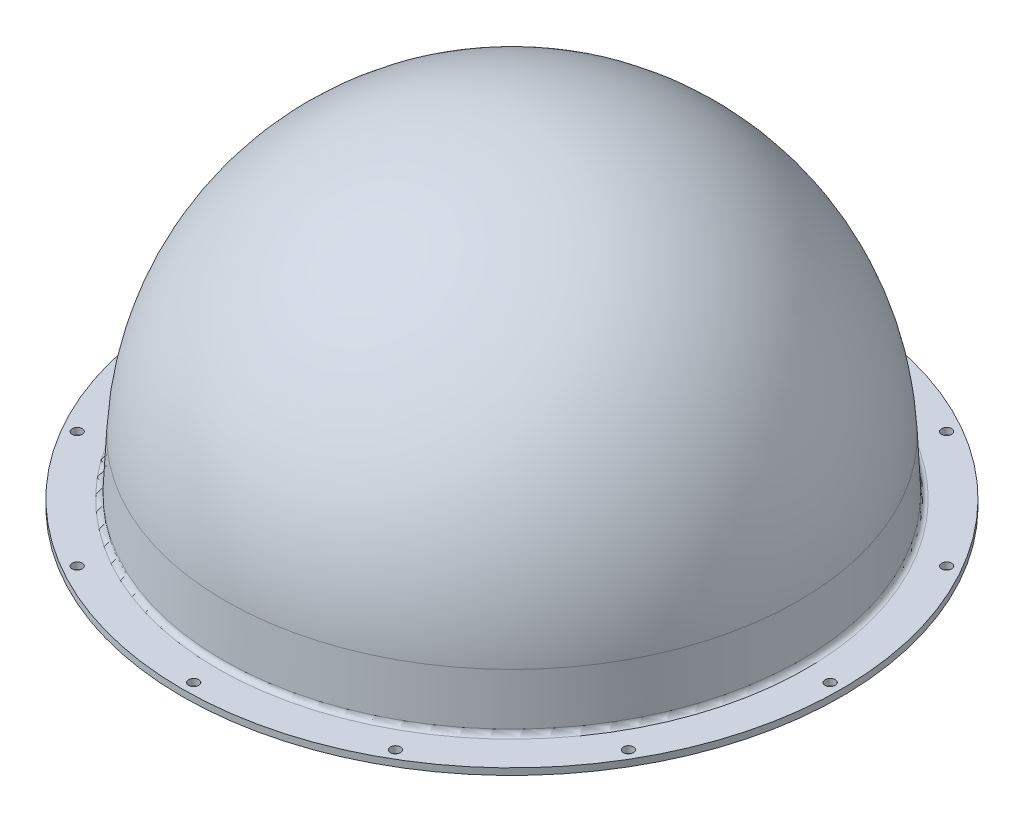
SolidWorks part; units mm, degrees
ref_plane "Front Plane" through (0, 0, 0) normal (0, 0, 1) x (1, 0, 0)
ref_plane "Top Plane" through (0, 0, 0) normal (0, 1, 0) x (1, 0, 0)
ref_plane "Right Plane" through (0, 0, 0) normal (1, 0, 0) x (0, 0, -1)
sketch "Sketch2" plane through (0, 0, 0) normal (0, 0, 1) x (1, 0, 0)
  line L0 (0, 0) -> (0, -52644.8542) construction
  line L1 (95.1934, 0) -> (108.27, 0)
  line L2 (108.27, 0) -> (108.27, 2.16)
  line L3 (108.27, 2.16) -> (96.7057, 2.16)
  line L4 (94.99, 3.791) -> (94.1593, 20.19)
  line L5 (91.115, 20.19) -> (92.015, 3.0162)
  line L6 (0, 0) -> (95.1934, 0) construction
  line L7 (-5.2775, 106.6549) -> (-40.7585, 106.6549) construction
  line L8 (-0.222, 109.7001) -> (-20.5561, 109.7001) construction
  line L9 (0, 109.7001) -> (0, 106.6549)
  arc A0 (96.7057, 2.16) -> (94.99, 3.791) centre (96.7057, 3.8779) cw
  arc A1 (94.1593, 20.19) -> (0, 109.7001) centre (0, 15.4201) ccw
  arc A2 (0, 106.6549) -> (91.115, 20.19) centre (0, 15.4149) cw
  arc A3 (92.015, 3.0162) -> (95.1934, 0) centre (95.1934, 3.1828) ccw
  dimension "D5" = 91.24
  dimension "D6" = 94.28
  dimension "D1" = 87.1
  dimension "D2" = 87
  dimension "D3" = 20.19
  dimension "D4" = 2.16
  dimension "D7" = 184.03
  dimension "D8" = 189.98
  dimension "D9" = 216.54
revolve "Revolve1" add sketch "Sketch2" angle 360 about L0
sketch "Sketch3" plane through (0, 2.16, 0) normal (0, 1, 0) x (1, 0, 0)
  circle A0 centre (0, 0) radius 104.55 construction
  circle A1 centre (0, 104.55) radius 1.65
  circle A2 centre (52.275, 90.543) radius 1.65
  circle A3 centre (90.543, 52.275) radius 1.65
  circle A4 centre (104.55, 0) radius 1.65
  circle A5 centre (90.543, -52.275) radius 1.65
  circle A6 centre (52.275, -90.543) radius 1.65
  circle A7 centre (0, -104.55) radius 1.65
  circle A8 centre (-52.275, -90.543) radius 1.65
  circle A9 centre (-90.543, -52.275) radius 1.65
  circle A10 centre (-104.55, 0) radius 1.65
  circle A11 centre (-90.543, 52.275) radius 1.65
  circle A12 centre (-52.275, 90.543) radius 1.65
  point P29 (0, 0)
  dimension "D1" = 209.1
  dimension "D2" = 3.3
  dimension "D3" = 12
extrude "Cut-Extrude1" cut sketch "Sketch3" against normal through all
